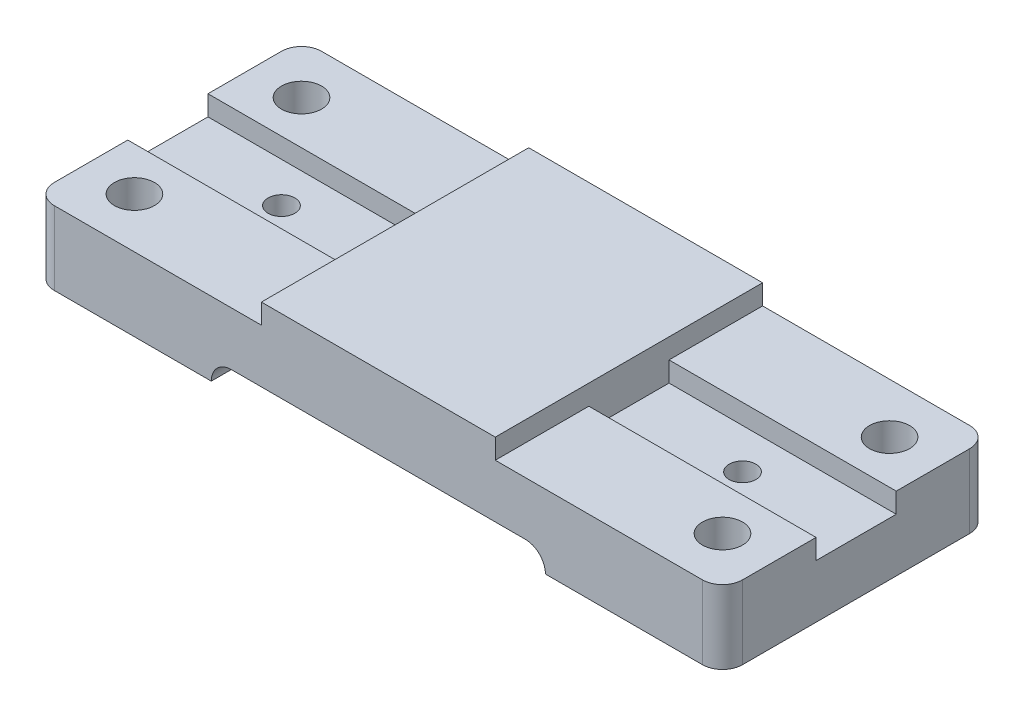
SolidWorks part; units mm, degrees
ref_plane "Front" through (0, 0, 0) normal (0, 0, 1) x (1, 0, 0)
ref_plane "Top" through (0, 0, 0) normal (0, 1, 0) x (1, 0, 0)
ref_plane "Right" through (0, 0, 0) normal (1, 0, 0) x (0, 0, -1)
sketch "Sketch1" plane through (0, 0, 0) normal (0, 1, 0) x (1, 0, 0)
  line L1 (6, 0) -> (200, 0)
  line L2 (0, 6) -> (0, 74)
  line L3 (6, 80) -> (200, 80)
  line L4 (206, 6) -> (206, 74)
  arc A0 (206, 74) -> (200, 80) centre (200, 74) ccw
  arc A1 (200, 0) -> (206, 6) centre (200, 6) ccw
  arc A2 (6, 0) -> (0, 6) centre (6, 6) cw
  arc A3 (6, 80) -> (0, 74) centre (6, 74) ccw
  circle A4 centre (15, 65) radius 6
  circle A5 centre (191, 65) radius 6
  circle A6 centre (15, 15) radius 6
  circle A7 centre (191, 15) radius 6
  point P7 (206, 80)
  point P12 (0, 0)
  point P15 (0, 80)
  dimension "D3" = 6
  dimension "D4" = 12
  dimension "D6" = 15
  dimension "D7" = 15
  dimension "D8" = 15
  dimension "D9" = 15
  dimension "D10" = 15
  dimension "D11" = 15
  dimension "D12" = 15
  dimension "D1" = 80
  dimension "D2" = 206
  dimension "D5" = 15
extrude "Extrude1" add sketch "Sketch1" along normal blind 22
sketch "Sketch2" plane through (0, 0, 0) normal (0, 0, 1) x (1, 0, 0)
  line L0 (103, 22) -> (103, 0) construction
  line L1 (6, 22) -> (200, 22) construction
  line L2 (6, 0) -> (200, 0) construction
  line L3 (53, 0) -> (153, 0)
  line L5 (59, 6) -> (147, 6)
  arc A0 (59, 6) -> (53, 0) centre (59, 0) ccw
  arc A1 (153, 0) -> (147, 6) centre (147, 0) ccw
  dimension "D1" = 6
extrude "Cut-Extrude1" cut sketch "Sketch2" against normal through all
sketch "Sketch3" plane through (0, 22, 0) normal (0, 1, 0) x (-1, 0, 0)
  line L0 (0, -40) -> (-206, -40) construction
  line L1 (0, -74) -> (0, -6) construction
  line L2 (-206, -6) -> (-206, -74) construction
  line L3 (0, -28) -> (-68, -28)
  line L4 (0, -52) -> (-68, -52)
  line L5 (0, -52) -> (0, -28)
  line L6 (-206, -52) -> (-206, -28)
  line L7 (-68, -52) -> (-68, -28)
  line L12 (-138, -52) -> (-138, -28)
  line L13 (-138, -28) -> (-206, -28)
  line L14 (0, -28) -> (-206, -28) construction
  line L15 (-138, -52) -> (-206, -52)
  line L16 (0, -52) -> (-206, -52) construction
  line L20 (-200, -80) -> (-6, -80)
  line L21 (0, -74) -> (0, -6)
  line L22 (-6, 0) -> (-200, 0)
  line L23 (-206, -6) -> (-206, -74)
  arc A12 (-206, -74) -> (-200, -80) centre (-200, -74) ccw
  arc A13 (-6, -80) -> (0, -74) centre (-6, -74) ccw
  arc A14 (0, -6) -> (-6, 0) centre (-6, -6) ccw
  arc A15 (-200, 0) -> (-206, -6) centre (-200, -6) ccw
extrude "Cut-Extrude2" cut sketch "Sketch3" against normal blind 6 contours L7 L4 L3 M14 | L15 L12 L13 M18
sketch "Sketch4" plane through (0, 22, 0) normal (0, 1, 0) x (-1, 0, 0)
  line L0 (-103, -80) -> (-103, 0) construction
  line L1 (-200, -80) -> (-6, -80) construction
  line L2 (-6, 0) -> (-200, 0) construction
  line L3 (-68, -80) -> (-68, 0)
  line L4 (-138, -80) -> (-138, 0)
  line L5 (-68, -80) -> (-138, -80)
  line L6 (-138, 0) -> (-68, 0)
extrude "Extrude2" add sketch "Sketch4" along normal blind 6
sketch "Sketch5" plane through (0, 0, 0) normal (0, -1, 0) x (1, 0, 0)
  line L0 (0, -40) -> (206, -40) construction
  line L1 (0, -74) -> (0, -6) construction
  line L2 (206, -6) -> (206, -74) construction
  circle A0 centre (34, -40) radius 7
  circle A1 centre (172, -40) radius 7
  dimension "D1" = 14
  dimension "D2" = 34
  dimension "D3" = 34
extrude "Cut-Extrude3" cut sketch "Sketch5" against normal blind 10
sketch "Sketch6" plane through (0, 10, 0) normal (0, -1, 0) x (1, 0, 0)
  circle A0 centre (34, -40) radius 4
  circle A1 centre (172, -40) radius 4
extrude "Cut-Extrude4" cut sketch "Sketch6" against normal blind 6
